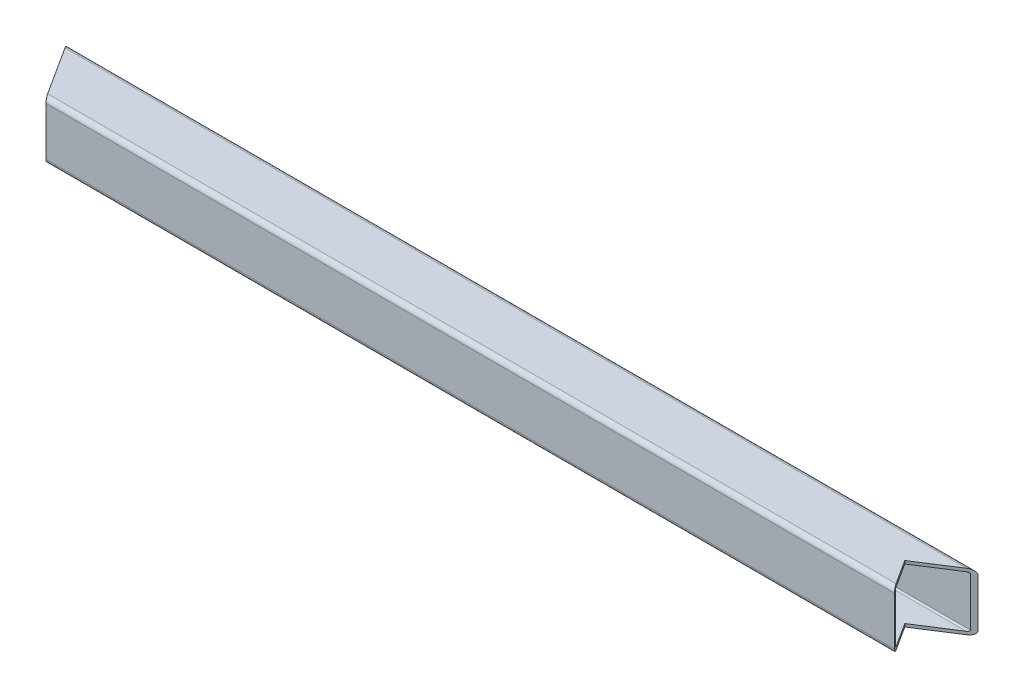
SolidWorks part; units mm, degrees
ref_plane "Front Plane" through (0, 0, 0) normal (0, 0, 1) x (1, 0, 0)
ref_plane "Top Plane" through (0, 0, 0) normal (0, 1, 0) x (1, 0, 0)
ref_plane "Right Plane" through (0, 0, 0) normal (1, 0, 0) x (0, 0, -1)
sketch "Sketch1" plane through (0, 0, 0) normal (1, 0, 0) x (0, 0, -1)
  line L0 (0, 2.54) -> (0, 29.21)
  line L1 (-2.54, 31.75) -> (-29.21, 31.75)
  line L2 (-31.75, 29.21) -> (-31.75, 2.54)
  line L3 (-29.21, 0) -> (-2.54, 0)
  line L4 (-1.651, 2.54) -> (-1.651, 29.21)
  line L5 (-2.54, 30.099) -> (-29.21, 30.099)
  line L6 (-30.099, 29.21) -> (-30.099, 2.54)
  line L7 (-29.21, 1.651) -> (-2.54, 1.651)
  arc A0 (-31.75, 2.54) -> (-29.21, 0) centre (-29.21, 2.54) ccw
  arc A1 (0, 2.54) -> (-2.54, 0) centre (-2.54, 2.54) cw
  arc A2 (0, 29.21) -> (-2.54, 31.75) centre (-2.54, 29.21) ccw
  arc A3 (-31.75, 29.21) -> (-29.21, 31.75) centre (-29.21, 29.21) cw
  arc A4 (-1.651, 29.21) -> (-2.54, 30.099) centre (-2.54, 29.21) ccw
  arc A5 (-30.099, 29.21) -> (-29.21, 30.099) centre (-29.21, 29.21) cw
  arc A6 (-30.099, 2.54) -> (-29.21, 1.651) centre (-29.21, 2.54) ccw
  arc A7 (-1.651, 2.54) -> (-2.54, 1.651) centre (-2.54, 2.54) cw
  point P12 (0, 0)
  point P15 (0, 31.75)
  point P18 (-31.75, 31.75)
  dimension "D3" = 2.54
  dimension "D1" = 31.75
  dimension "D2" = 31.75
  dimension "D4" = 1.651
extrude "Boss-Extrude1" add sketch "Sketch1" along normal blind 698.5
sketch "Sketch2" plane through (0, 0, 0) normal (0, -1, 0) x (1, 0, 0)
  line L0 (563.6585, 14.4051) -> (680.9109, -60.8465)
  line L1 (680.9109, -60.8465) -> (741.2769, 33.2121)
  line L2 (741.2769, 33.2121) -> (621.8868, 109.8355)
  line L3 (544.372, -10.9434) -> (808.4649, 400.5503) construction
  line L4 (621.8868, 109.8355) -> (561.5209, 15.777)
  line L5 (561.5209, 15.777) -> (563.9244, 14.2344)
  line L6 (0, 29.21) -> (0, 2.54) construction
  dimension "D1" = 563.9244
  dimension "D2" = 621.8868
  dimension "D3" = 680.9109
extrude "Cut-Extrude2" cut sketch "Sketch2" against normal blind 38.1 contours L4 L5 L0 M2 M3 M4 | L2 L4 L0 L1 M4 M3 M2
sketch "Sketch3" plane through (0, 0, 0) normal (0, -1, 0) x (1, 0, 0)
  line L0 (98.4849, 23.2108) -> (46.9712, -57.0546)
  line L1 (46.9712, -57.0546) -> (-37.6848, -2.7231)
  line L2 (-37.6848, -2.7231) -> (16.3534, 81.4759)
  line L3 (16.3534, 81.4759) -> (25.3977, 95.5683)
  line L4 (25.3977, 95.5683) -> (110.0538, 41.2368)
  line L5 (99.8568, 25.3485) -> (477.1324, 613.1965) construction
  line L6 (110.0538, 41.2368) -> (98.4849, 23.2108)
  dimension "D1" = 16.3534
  dimension "D2" = 25.3977
  dimension "D3" = 46.9712
  dimension "D4" = 110.0538
extrude "Cut-Extrude3" cut sketch "Sketch3" against normal blind 38.1
